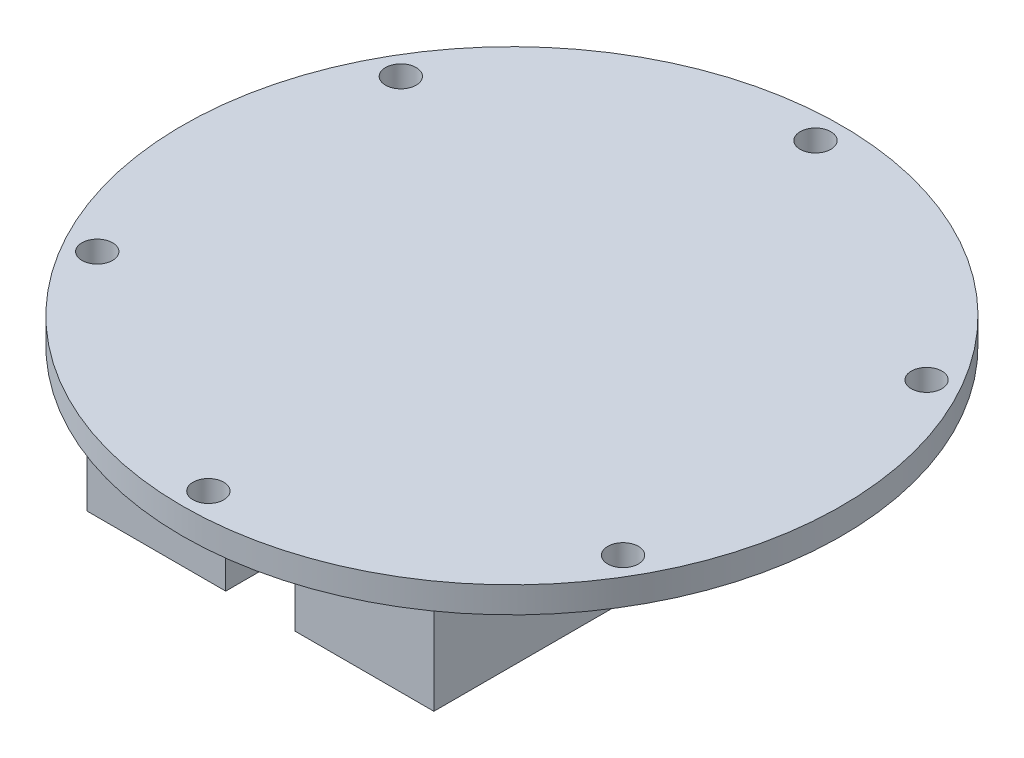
SolidWorks part; units mm, degrees
ref_plane "Front" through (0, 0, 0) normal (0, 0, 1) x (1, 0, 0)
ref_plane "Top" through (0, 0, 0) normal (0, 1, 0) x (1, 0, 0)
ref_plane "Right" through (0, 0, 0) normal (1, 0, 0) x (0, 0, -1)
sketch "Sketch1" plane through (0, 0, 0) normal (0, 0, 1) x (1, 0, 0)
  line L1 (-60.325, -152.4) -> (0, -152.4)
  line L2 (-60.325, -152.4) -> (-60.325, -157.1625)
  line L3 (-60.325, -157.1625) -> (0, -157.1625)
  line L4 (0, -152.4) -> (0, -157.1625)
  line L5 (0, 0) -> (0, -163.1923) construction
  dimension "D2" = 4.7625
revolve "Revolve1" add sketch "Sketch1" angle 360 about L5
hole_wizard "#2 (0.221) Diameter Hole1" positions "Sketch3" profile "Sketch2" hole size "#2" standard "Ansi Inch"
sketch "Sketch3" plane through (0, -157.1625, 0) normal (0, -1, 0) x (1, 0, 0)
  point P1 (0, 55.5625)
  point P4 (48.1185, 27.7813)
  point P7 (48.1185, -27.7812)
  point P10 (0, -55.5625)
  point P13 (-48.1185, -27.7812)
  point P16 (-48.1185, 27.7813)
sketch "Sketch2" plane through (0, -157.1625, 55.5625) normal (1, 0, 0) x (0, 0, -1)
  line L0 (0, 0) -> (0, 4.7625)
  line L1 (0, 4.7625) -> (2.8067, 4.7625)
  line L2 (2.8067, 4.7625) -> (2.8067, 0)
  line L5 (2.8067, 0) -> (0, 0)
  line L11 (0, -6.35) -> (0, 107.95) construction
  dimension "Thru Hole Dia." = 5.6134
  dimension "Thru Hole Depth" = 4.7625
sketch "Sketch4" plane through (0, -157.1625, 0) normal (0, -1, 0) x (1, 0, 0)
  line L0 (0, 0) -> (0, 73.0075) construction
  line L1 (-31.75, 46.0375) -> (-6.35, 46.0375)
  line L2 (-31.75, 46.0375) -> (-31.75, -46.0375)
  line L3 (-31.75, -46.0375) -> (-6.35, -46.0375)
  line L4 (-6.35, 46.0375) -> (-6.35, -46.0375)
  line L5 (6.35, 46.0375) -> (6.35, -46.0375)
  line L6 (31.75, -46.0375) -> (6.35, -46.0375)
  line L7 (31.75, 46.0375) -> (31.75, -46.0375)
  line L8 (31.75, 46.0375) -> (6.35, 46.0375)
  dimension "D1" = 25.4
  dimension "D2" = 92.075
  dimension "D3" = 6.35
  dimension "D4" = 46.0375
extrude "Extrude1" add sketch "Sketch4" along normal blind 19.05
equation "\"D4@Sketch4\" = \"D2@Sketch4\"/2"
